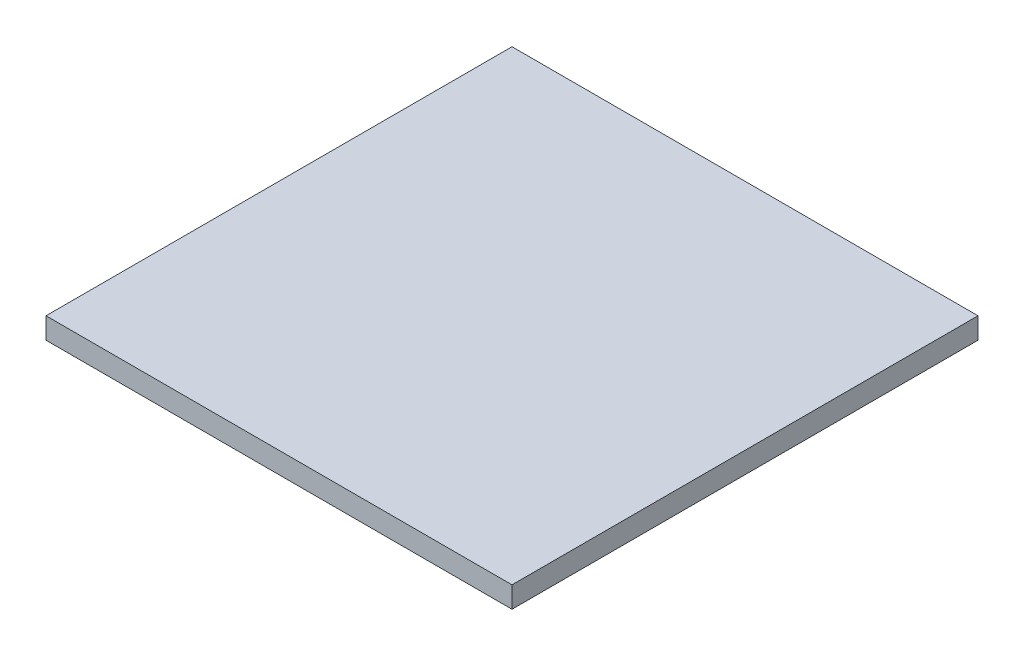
SolidWorks part; units mm, degrees
ref_plane "Front Plane" through (0, 0, 0) normal (0, 0, 1) x (1, 0, 0)
ref_plane "Top Plane" through (0, 0, 0) normal (0, 1, 0) x (1, 0, 0)
ref_plane "Right Plane" through (0, 0, 0) normal (1, 0, 0) x (0, 0, -1)
sketch "Sketch1" plane through (0, 0, 0) normal (0, 1, 0) x (1, 0, 0)
  line L0 (0, 139.7) -> (0, 0) construction
  line L1 (0, 0) -> (279.4, 0)
  line L2 (0, 0) -> (0, 279.4)
  line L3 (0, 279.4) -> (279.4, 279.4)
  line L4 (279.4, 0) -> (279.4, 279.4)
  line L5 (0, 69.85) -> (279.4, 69.85) construction
  line L6 (0, 139.7) -> (0, 279.4) construction
  line L7 (0, 209.55) -> (279.4, 209.55) construction
  line L8 (0, 279.4) -> (-19.05, 279.4) construction
  line L9 (-19.05, 279.4) -> (-19.05, 0) construction
  line L10 (-19.05, 0) -> (0, 0) construction
  line L11 (0, 209.55) -> (-19.05, 209.55) construction
  line L12 (0, 69.85) -> (-19.05, 69.85) construction
  line L13 (0, 139.7) -> (-19.05, 139.7) construction
  line L14 (0, 209.55) -> (-279.4, 209.55) construction
  line L15 (0, 279.4) -> (-279.4, 279.4)
  line L16 (0, 279.4) -> (0, 0)
  line L17 (0, 0) -> (-279.4, 0)
  line L18 (-279.4, 279.4) -> (-279.4, 0)
  line L19 (0, 69.85) -> (-279.4, 69.85) construction
  line L20 (-139.7, 279.4) -> (-139.7, 0) construction
  line L21 (-209.55, 279.4) -> (-209.55, 0) construction
  line L22 (-69.85, 279.4) -> (-69.85, 0) construction
  line L23 (-279.4, 260.35) -> (0, 260.35) construction
  line L24 (279.4, 260.35) -> (0, 260.35) construction
  line L25 (139.7, 279.4) -> (139.7, 0) construction
  line L26 (209.55, 279.4) -> (209.55, 0) construction
  line L27 (69.85, 279.4) -> (69.85, 0) construction
  line L28 (69.85, 279.4) -> (69.85, 260.35) construction
  line L29 (209.55, 279.4) -> (209.55, 260.35) construction
  line L30 (139.7, 279.4) -> (139.7, 260.35) construction
  line L31 (298.45, 279.4) -> (298.45, 0) construction
  line L32 (279.4, 69.85) -> (298.45, 69.85) construction
  line L33 (275.4373, 209.55) -> (298.45, 209.55) construction
  line L34 (298.45, 139.7) -> (279.4, 139.7) construction
  line L35 (279.4, 577.85) -> (0, 577.85) construction
  line L36 (0, 279.4) -> (279.4, 279.4)
  line L37 (0, 279.4) -> (0, 558.8)
  line L38 (0, 558.8) -> (279.4, 558.8)
  line L39 (279.4, 279.4) -> (279.4, 558.8)
  line L40 (139.7, 279.4) -> (139.7, 558.8) construction
  line L41 (0, 419.1) -> (279.4, 419.1) construction
  line L42 (298.45, 558.8) -> (298.45, 279.4) construction
  line L43 (279.4, 349.25) -> (298.45, 349.25) construction
  line L44 (275.4373, 488.95) -> (298.45, 488.95) construction
  line L45 (298.45, 419.1) -> (235.7709, 419.1) construction
  line L46 (-19.05, 558.8) -> (-19.05, 279.4) construction
  ellipse E0 centre (-19.05, 209.55) end of major axis (-19.05, 241.3) minor radius 25.4
  ellipse E1 centre (-209.55, 260.35) end of major axis (-241.3, 260.35) minor radius 25.4
  ellipse E2 centre (-19.05, 139.7) end of major axis (-19.05, 107.95) minor radius 25.4
  ellipse E3 centre (-19.05, 69.85) end of major axis (-19.05, 38.1) minor radius 25.4
  ellipse E4 centre (-139.7, 260.35) end of major axis (-171.45, 260.35) minor radius 25.4
  ellipse E5 centre (-69.85, 260.35) end of major axis (-101.6, 260.35) minor radius 25.4
  ellipse E6 centre (69.85, 260.35) end of major axis (38.1, 260.35) minor radius 25.4
  ellipse E7 centre (139.7, 260.35) end of major axis (107.95, 260.35) minor radius 25.4
  ellipse E8 centre (209.55, 260.35) end of major axis (177.8, 260.35) minor radius 25.4
  ellipse E9 centre (298.45, 209.55) end of major axis (298.45, 177.8) minor radius 25.4
  ellipse E10 centre (298.45, 139.7) end of major axis (298.45, 107.95) minor radius 25.4
  ellipse E11 centre (298.45, 69.85) end of major axis (298.45, 38.1) minor radius 25.4
  ellipse E12 centre (69.85, 577.85) end of major axis (38.1, 577.85) minor radius 25.4
  ellipse E13 centre (139.7, 577.85) end of major axis (107.95, 577.85) minor radius 25.4
  ellipse E14 centre (209.55, 577.85) end of major axis (177.8, 577.85) minor radius 25.4
  ellipse E15 centre (298.45, 488.95) end of major axis (298.45, 520.7) minor radius 25.4
  ellipse E16 centre (298.45, 419.1) end of major axis (298.45, 450.85) minor radius 25.4
  ellipse E17 centre (298.45, 349.25) end of major axis (298.45, 381) minor radius 25.4
  ellipse E18 centre (-19.05, 488.95) end of major axis (-19.05, 520.7) minor radius 25.4
  ellipse E19 centre (-19.05, 419.1) end of major axis (-19.05, 450.85) minor radius 25.4
  ellipse E20 centre (-19.05, 349.25) end of major axis (-19.05, 381) minor radius 25.4
  dimension "D4" = 31.75
  dimension "D5" = 25.4
  dimension "D6" = 25.4
  dimension "D1" = 279.4
  dimension "D2" = 279.4
  dimension "D3" = 19.05
  dimension "D7" = 25.4
  dimension "D8" = 279.4
  dimension "D9" = 69.85
  dimension "D10" = 69.85
  dimension "D11" = 19.05
  dimension "D12" = 31.75
  dimension "D13" = 25.4
  dimension "D14" = 19.05
  dimension "D15" = 69.85
  dimension "D16" = 69.85
  dimension "D17" = 19.05
  dimension "D18" = 279.4
  dimension "D19" = 19.05
  dimension "D20" = 19.05
  dimension "D21" = 19.05
extrude "Boss-Extrude1" add sketch "Sketch1" along normal blind 12.7 contours E5 L15 E4 E1 L18 L17 L2 E3 E2 E0 | L15 E1 | L15 E4 | L15 E5 | L16 E0 | L16 E2 | L16 E3
